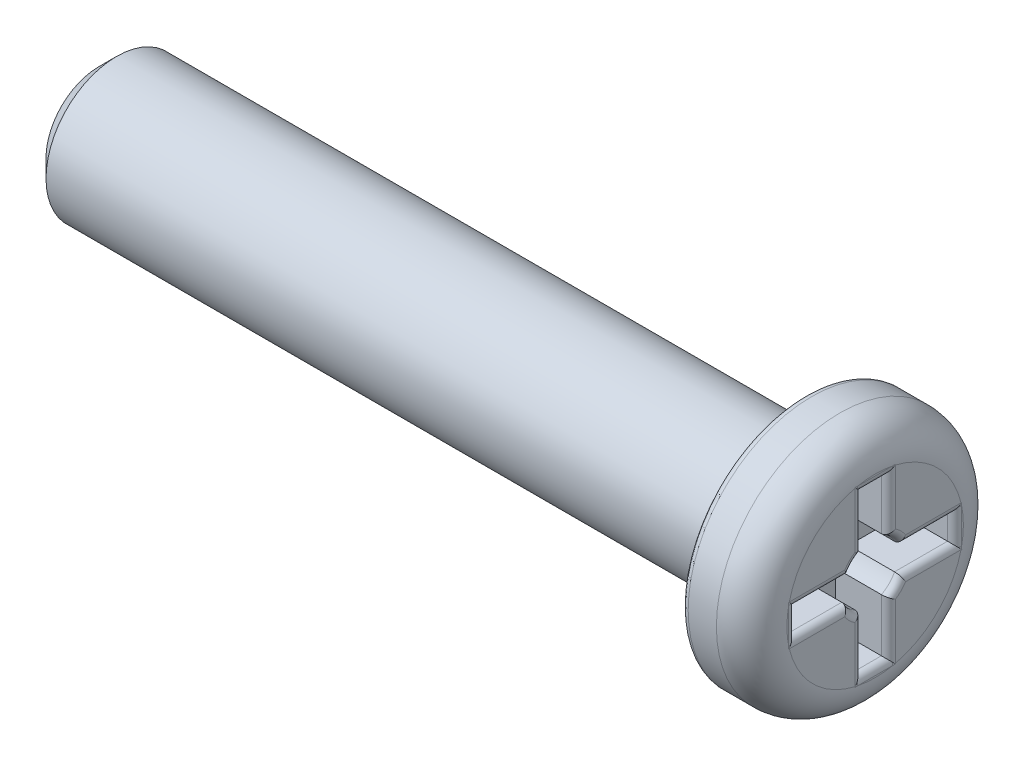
SolidWorks part; units mm, degrees
ref_plane "Face" through (0, 0, 0) normal (0, 0, 1) x (1, 0, 0)
ref_plane "Dessus" through (0, 0, 0) normal (0, 1, 0) x (1, 0, 0)
ref_plane "Droite" through (0, 0, 0) normal (1, 0, 0) x (0, 0, -1)
sketch "Esquisse1" plane through (0, 0, 0) normal (0, 0, 1) x (1, 0, 0)
  line L0 (0, 0) -> (5, 0) construction
  line L1 (0, 0) -> (0, 2)
  line L2 (0, 2) -> (20, 2)
  line L3 (20, 2) -> (20, 3.5)
  line L4 (20, 3.5) -> (21, 3.5)
  line L5 (22, 2.5) -> (22, 0)
  line L6 (0, 0) -> (22, 0)
  arc A0 (21, 3.5) -> (22, 2.5) centre (21, 2.5) cw
  point P10 (22, 3.5)
  dimension "D5" = 1
  dimension "D1" = 4
  dimension "D2" = 20
  dimension "D3" = 2
  dimension "D4" = 7
revolve "Révolution1" add sketch "Esquisse1" angle 360 about L0
sketch "Esquisse2" plane through (22, 0, 0) normal (1, 0, 0) x (0, 0, -1)
  line L0 (0, 0) -> (0, 2.6874) construction
  line L1 (0.375, 0) -> (-0.375, 0)
  line L2 (-0.375, 0) -> (-0.375, 2.25)
  line L3 (0.375, 0) -> (0.375, 2.25)
  line L4 (-0.375, 2.25) -> (0.375, 2.25)
  point P8 (0, 2.25)
  dimension "D1" = 0.75
  dimension "D2" = 2.25
extrude "Enlèv. mat.-Extru.1" cut sketch "Esquisse2" against normal blind 1.5
pattern_circular "Répétition circulaire1" count 4 over 360 about axis through (0, 0, 0) along (1, 0, 0)
sketch "Esquisse3" plane through (22, 0, 0) normal (1, 0, 0) x (0, 0, -1)
  circle A0 centre (0, 0) radius 0.8365
extrude "Enlèv. mat.-Extru.2" cut sketch "Esquisse3" against normal up to surface (1.5 mm away)
fillet "Congé2" radius 0.2
chamfer "Chanfrein1" distance 0.5 angle 45
